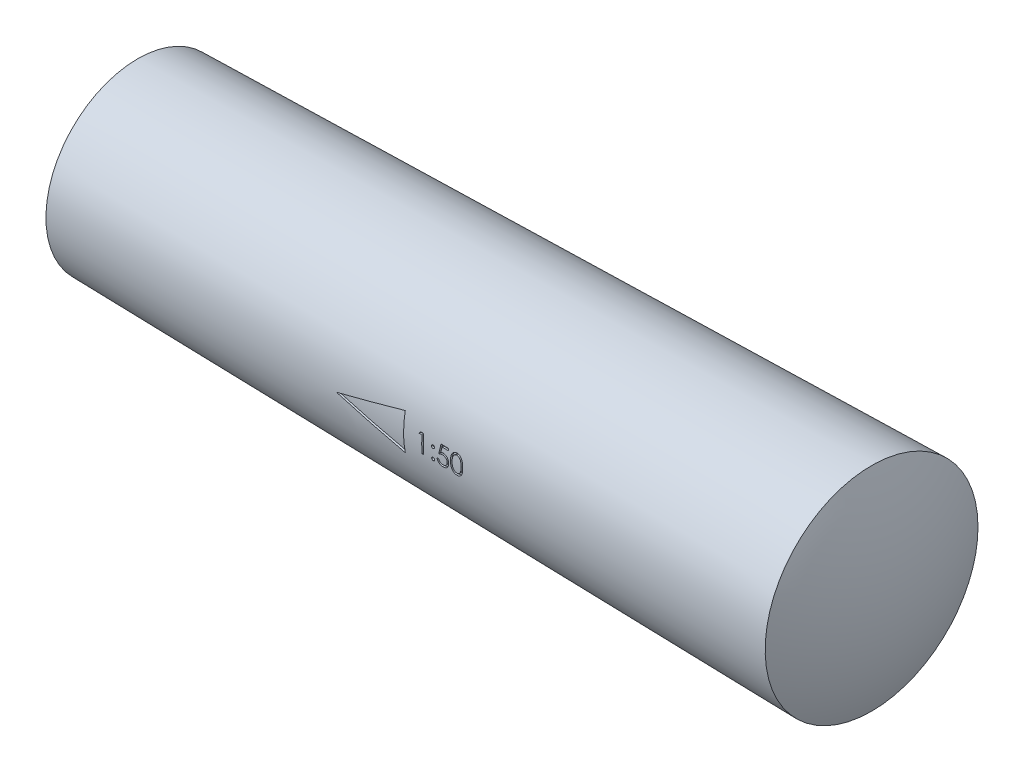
SolidWorks part; units mm, degrees
ref_plane "Front Plane" through (0, 0, 0) normal (0, 0, 1) x (1, 0, 0)
ref_plane "Top Plane" through (0, 0, 0) normal (0, 1, 0) x (1, 0, 0)
ref_plane "Right Plane" through (0, 0, 0) normal (1, 0, 0) x (0, 0, -1)
sketch "Sketch1" plane through (0, 0, 0) normal (1, 0, 0) x (0, 0, -1)
  circle A0 centre (0, 0) radius 5
  dimension "D1" = 10
extrude "Extrude1" add sketch "Sketch1" along normal mid plane 40
draft "Draft1" type of draft neutral plane draft angle 1.146 faces to draft 1 parameters "D1"=1.146
sketch "Sketch2" plane through (0, 0, 0) normal (0, 0, 1) x (1, 0, 0)
  line L0 (-20, 0) -> (-20, 5)
  line L1 (-20, 5) -> (-20, -5) construction
  line L2 (-20, 0) -> (-21.2, 0)
  line L3 (-21.2, 0) -> (-21.2, -5.4) construction
  line L4 (20, 0) -> (20, 5.8)
  line L5 (20, -5.8) -> (20, 5.8) construction
  line L6 (20, 0) -> (21.2, 0)
  line L7 (21.2, 0) -> (21.2, -5.4) construction
  line L8 (-20, -5) -> (20, -5.8) construction
  arc A0 (-21.2, 0) -> (-20, 5) centre (-10.1833, 0) cw
  arc A1 (21.2, 0) -> (20, 5.8) centre (6.5832, 0) ccw
  point P14 (0, -5.4)
revolve "Revolve1" add sketch "Sketch2" angle 360 about L2
sketch "Sketch5" plane through (0, 0, 0) normal (0, 0, 1) x (1, 0, 0)
  line L0 (0, 5.4) -> (0, -5.4) construction
  line L1 (20, 5.8) -> (-20, 5) construction
  line L2 (-20, -5) -> (20, -5.8) construction
ref_plane "Plane2" through (0, 0, 0) normal (-0.02, 0, 0.9998) x (0.9998, 0, 0.02)
sketch "Sketch6" plane through (0, 0, 0) normal (-0.02, 0, 0.9998) x (0.9998, 0, 0.02)
  line L0 (0, 0) -> (0, 1)
  line L1 (0, 5.4) -> (0, -5.4) construction
  line L2 (0, 1) -> (-3.7321, 0)
  line L3 (-3.7321, 0) -> (0, -1)
  line L4 (0, -1) -> (0, 0)
  line L5 (0, -0.5) -> (4, -0.5) construction
  text T0 "1:50" font "Century Gothic" height 1
  dimension "D1" = 2
  dimension "D2" = 30
  dimension "D3" = 4
wrap "Wrap2" sketch "Sketch6" wrap type deboss source sketch "Sketch6" thickness 0.1 parameters "D1"=0.1
equation "\"D2@Sketch2\" = \"D1@Sketch2\""
